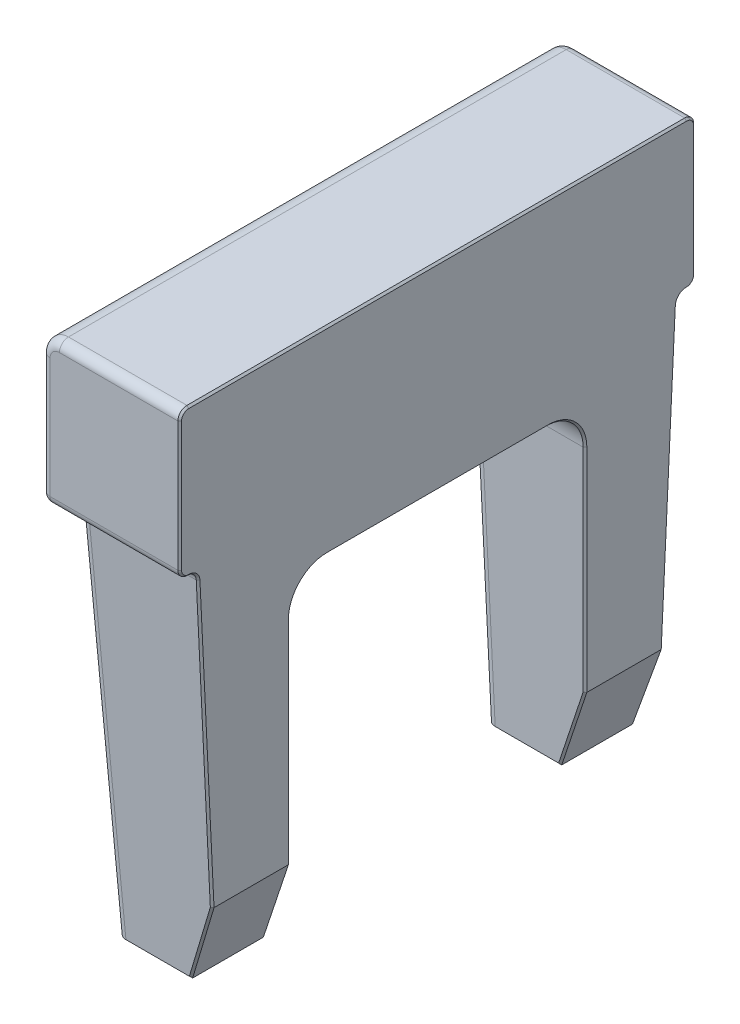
SolidWorks part; units mm, degrees
ref_plane "Спереди" through (0, 0, 0) normal (0, 0, 1) x (1, 0, 0)
ref_plane "Сверху" through (0, 0, 0) normal (0, 1, 0) x (1, 0, 0)
ref_plane "Справа" through (0, 0, 0) normal (1, 0, 0) x (0, 0, -1)
sketch "Эскиз1" plane through (0, 0, 0) normal (1, 0, 0) x (0, 0, -1)
  line L0 (0, 14.913) -> (0, -11.4376) construction
  line L1 (3, 0) -> (-3, 0)
  line L2 (-4, -1) -> (-4, -8.81)
  line L3 (-4, -8.81) -> (-6.02, -8.81)
  line L4 (-6.02, -8.81) -> (-6.5016, 1.1269)
  line L5 (4, -1) -> (4, -8.81)
  line L6 (4, -8.81) -> (6.02, -8.81)
  line L7 (6.02, -8.81) -> (6.5016, 1.1269)
  line L8 (-6.7464, 1.36) -> (-6.755, 1.36)
  line L9 (-7, 1.605) -> (-7, 5.36)
  line L10 (-7, 5.36) -> (7, 5.36)
  line L11 (7, 1.605) -> (7, 5.36)
  line L12 (6.7464, 1.36) -> (6.755, 1.36)
  arc A0 (-3, 0) -> (-4, -1) centre (-3, -1) ccw
  arc A1 (3, 0) -> (4, -1) centre (3, -1) cw
  arc A2 (6.5016, 1.1269) -> (6.7464, 1.36) centre (6.7464, 1.115) cw
  arc A3 (7, 1.605) -> (6.755, 1.36) centre (6.755, 1.605) cw
  arc A4 (-6.5016, 1.1269) -> (-6.7464, 1.36) centre (-6.7464, 1.115) ccw
  arc A5 (-6.755, 1.36) -> (-7, 1.605) centre (-6.755, 1.605) cw
  point P11 (0, 0)
  point P20 (0, 5.36)
  point P23 (6.5129, 1.36)
  point P26 (7, 1.36)
  point P29 (-6.5129, 1.36)
  point P32 (-7, 1.36)
  dimension "D3" = 1
  dimension "D9" = 0.245
  dimension "D1" = 8
  dimension "D2" = 8.81
  dimension "D4" = 2.02
  dimension "D5" = 5.55
  dimension "D6" = 14.17
  dimension "D7" = 4
  dimension "D8" = 14
extrude "Бобышка-Вытянуть1" add sketch "Эскиз1" along normal blind 3.765
sketch "Эскиз2" plane through (0, 0, 0) normal (0, 0, 1) x (1, 0, 0)
  line L0 (3.765, 5.36) -> (3.765, -6.7658)
  line L1 (3.765, 1.1269) -> (3.765, -8.81) construction
  line L2 (1.085, -8.81) -> (0.5642, 1.1278)
  line L3 (3.765, -8.81) -> (0, -8.81) construction
  line L5 (1.085, -8.81) -> (3.085, -8.81)
  line L6 (3.085, -8.81) -> (3.765, -6.7658)
  line L7 (0.3195, 1.36) -> (0.245, 1.36)
  line L8 (0, 1.605) -> (0, 4.86)
  line L9 (0, 5.36) -> (0, 1.605) construction
  line L10 (0.5, 5.36) -> (3.765, 5.36)
  line L11 (3.765, 1.36) -> (0, 1.36) construction
  arc A0 (0.5642, 1.1278) -> (0.3195, 1.36) centre (0.3195, 1.115) ccw
  arc A1 (0.245, 1.36) -> (0, 1.605) centre (0.245, 1.605) cw
  arc A2 (0, 4.86) -> (0.5, 5.36) centre (0.5, 4.86) cw
  point P26 (0, 5.36)
  dimension "D3" = 0.245
  dimension "D4" = 0.5
  dimension "D1" = 2.68
  dimension "D2" = 3
  dimension "D5" = 2
  dimension "D6" = 18.4
extrude "Вырез-Вытянуть1" cut sketch "Эскиз2" against normal mid plane 15 flip side to cut
fillet "Скругление1" radius 0.245 19 edges at (0.4882, 1.2927, -6.5777) (0.5642, 1.1273, -6.5017) (0.4882, 1.2927, 6.5777) (0.5642, 1.1273, 6.5017) (0.0718, 1.4318, -6.9282) (2.1325, 5.36, -7) (0.1464, 5.2136, -7) (2.1325, 5.36, 7) (0.1464, 5.2136, 7) (0.0718, 1.4318, 6.9282) (0.8246, -3.8416, -6.2608) (0.8246, -3.8416, 6.2608) (0, 3.2325, -7) (0, 3.2325, 7) (0.8803, -4.905, 4) (0.6386, -0.2929, 3.7071) (0.6233, 0, 0) (0.6386, -0.2929, -3.7071) (0.8803, -4.905, -4)
chamfer "Фаска1" distance 0.05 angle 45 32 edges at (3.425, -7.7879, -6.0695) (3.425, -7.7879, 4) (3.765, -3.8829, 4) (2.2074, -8.81, -6.02) (3.765, -0.2929, 3.7071) (1.1566, -8.81, -5.9484) (3.765, 0, 0) (1.085, -8.81, -5.0102) (3.765, -0.2929, -3.7071) (1.1569, -8.81, -4.0718) (3.765, -3.8829, -4) (3.425, -7.7879, -4) (2.2077, -8.81, -4) (2.2077, -8.81, 4) (1.1569, -8.81, 4.0718) (1.085, -8.81, 5.0102) (1.1566, -8.81, 5.9484) (2.2074, -8.81, 6.02) (3.425, -7.7879, 6.0695) (3.765, -2.8195, -6.3104) (3.765, -2.8195, 6.3104) (3.765, 1.2924, -6.5774) (3.765, 1.2924, 6.5774) (3.765, 1.36, -6.7507) (3.765, 1.36, 6.7507) (3.765, 1.4318, -6.9282) (3.765, 1.4318, 6.9282) (3.765, 3.36, -7) (3.765, 3.36, 7) (3.765, 5.2882, -6.9282) (3.765, 5.2882, 6.9282) (3.765, 5.36, 0)
